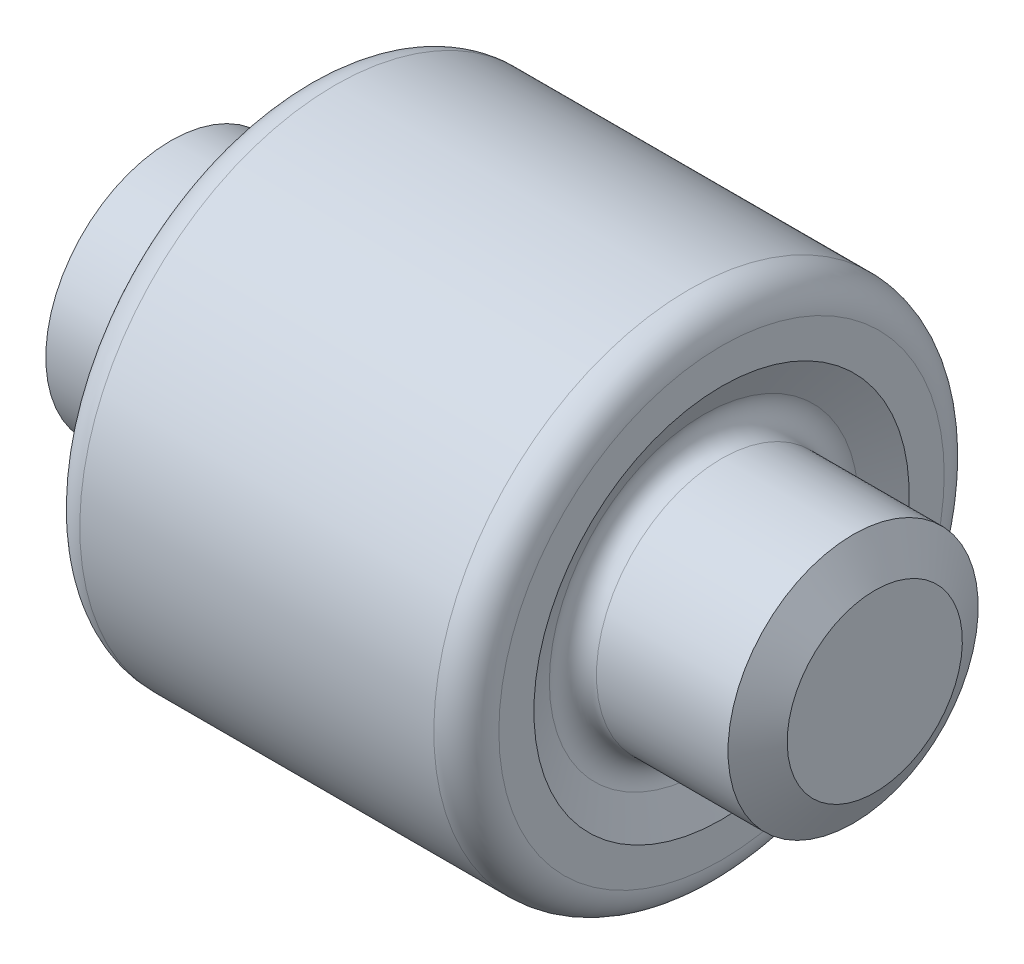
SolidWorks part; units mm, degrees
ref_plane "Plan de face" through (0, 0, 0) normal (0, 0, 1) x (1, 0, 0)
ref_plane "Plan de dessus" through (0, 0, 0) normal (0, 1, 0) x (1, 0, 0)
ref_plane "Plan de droite" through (0, 0, 0) normal (1, 0, 0) x (0, 0, -1)
sketch "Esquisse1" plane through (0, 0, 0) normal (0, 0, 1) x (1, 0, 0)
  line L0 (0, 0) -> (0, 3.5)
  line L1 (0, 3.5) -> (0.866, 5)
  line L2 (0.866, 5) -> (6.125, 5)
  line L3 (6.8309, 6.1765) -> (6.125, 7.5)
  line L4 (6.125, 7.5) -> (6.125, 8.9)
  line L5 (7.425, 10.2) -> (14.5, 10.2)
  line L6 (14.5, 10.2) -> (14.5, 0)
  line L7 (14.5, 0) -> (0, 0)
  line L8 (6.125, 7.5) -> (6.125, 5.8) construction
  line L9 (5.3731, 5.8) -> (6.125, 5.8) construction
  arc A0 (6.125, 8.9) -> (7.425, 10.2) centre (7.425, 8.9) cw
  arc A1 (6.125, 5) -> (6.8309, 6.1765) centre (6.125, 5.8) ccw
  dimension "D7" = 1.3
  dimension "D10" = 1.6
  dimension "D1" = 14.5
  dimension "D2" = 30
  dimension "D3" = 3.5
  dimension "D4" = 6.125
  dimension "D5" = 10.2
  dimension "D6" = 5
  dimension "D8" = 7.5
  dimension "D9" = 0.8
revolve "Révolution1" add sketch "Esquisse1" angle 360 about L7
mirror "Symétrie1" about plane through (14.5, 10.2, 0) normal (1, 0, 0) of "Révolution1"
